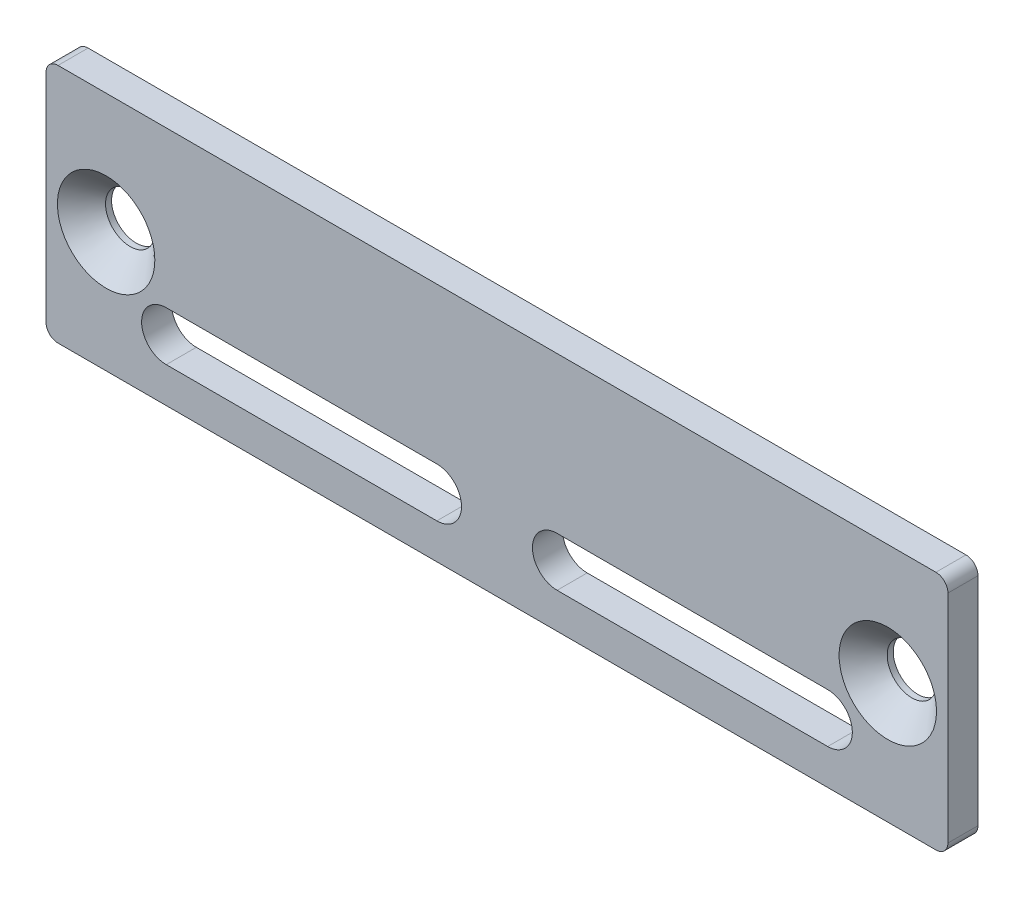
SolidWorks part; units mm, degrees
ref_plane "Спереди" through (0, 0, 0) normal (0, 0, 1) x (1, 0, 0)
ref_plane "Сверху" through (0, 0, 0) normal (0, 1, 0) x (1, 0, 0)
ref_plane "Справа" through (0, 0, 0) normal (1, 0, 0) x (0, 0, -1)
sketch "Эскиз1" plane through (0, 0, 0) normal (0, 0, 1) x (1, 0, 0)
  line L1 (-73, 20) -> (73, 20)
  line L2 (-75, 18) -> (-75, -18)
  line L3 (-73, -20) -> (73, -20)
  line L4 (75, 18) -> (75, -18)
  line L5 (-75, 20) -> (75, -20) construction
  line L6 (-75, -20) -> (75, 20) construction
  arc A0 (-75, -18) -> (-73, -20) centre (-73, -18) ccw
  arc A1 (73, -20) -> (75, -18) centre (73, -18) ccw
  arc A2 (73, 20) -> (75, 18) centre (73, 18) cw
  arc A3 (-73, 20) -> (-75, 18) centre (-73, 18) ccw
  point P0 (0, 0)
  dimension "D3" = 2
  dimension "D1" = 40
  dimension "D2" = 150
extrude "Бобышка-Вытянуть1" add sketch "Эскиз1" along normal blind 5
sketch "Эскиз2" plane through (0, 0, 5) normal (0, 0, 1) x (1, 0, 0)
  line L0 (-55, -10) -> (-10, -10) construction
  line L1 (-55, -5.9) -> (-10, -5.9)
  line L2 (-55, -14.1) -> (-10, -14.1)
  line L3 (0, -20) -> (0, 20) construction
  line L4 (-73, -20) -> (73, -20) construction
  line L5 (73, 20) -> (-73, 20) construction
  line L6 (55, -10) -> (10, -10) construction
  line L7 (55, -5.9) -> (10, -5.9)
  line L8 (55, -14.1) -> (10, -14.1)
  arc A0 (-55, -5.9) -> (-55, -14.1) centre (-55, -10) ccw
  arc A1 (-10, -14.1) -> (-10, -5.9) centre (-10, -10) ccw
  arc A2 (55, -5.9) -> (55, -14.1) centre (55, -10) cw
  arc A3 (10, -14.1) -> (10, -5.9) centre (10, -10) cw
  point P2 (-32.5, -10)
  point P15 (32.5, -10)
  dimension "D1" = 4.1
  dimension "D3" = 10
  dimension "D4" = 20
  dimension "D2" = 45
extrude "Вырез-Вытянуть1" cut sketch "Эскиз2" against normal through all
hole_wizard "Диаметр отверстия Ø8.2 (8.2)1" positions "Эскиз3" profile "Эскиз4" hole size "Ø8.2" standard "DIN"
sketch "Эскиз3" plane through (0, 0, 5) normal (0, 0, 1) x (1, 0, 0)
  line L0 (0, 20) -> (0, -20) construction
  line L1 (73, 20) -> (-73, 20) construction
  line L2 (-73, -20) -> (73, -20) construction
  line L4 (-75, 0) -> (75, 0) construction
  line L5 (-75, 18) -> (-75, -18) construction
  line L6 (75, -18) -> (75, 18) construction
  point P0 (-65, 0)
  point P11 (65, 0)
  point P19 (0, 0)
  dimension "D1" = 130
sketch "Эскиз4" plane through (-65, 0, 5) normal (1, 0, 0) x (0, -1, 0)
  line L0 (0, 0) -> (0, 5)
  line L1 (0, 5) -> (4.1, 5)
  line L2 (4.1, 5) -> (4.1, 4)
  line L3 (4.1, 4) -> (8.1, 0)
  line L5 (8.1, 0) -> (0, 0)
  line L6 (-4.1, 4) -> (-8.1, 0) construction
  line L11 (0, -6.35) -> (0, 107.95) construction
  dimension "Диаметр сквозного отверстия" = 8.2
  dimension "Глубина сквозного отверстия" = 5
  dimension "Диаметр передней зенковки" = 16.2
  dimension "Угол передней зенковки" = 90
